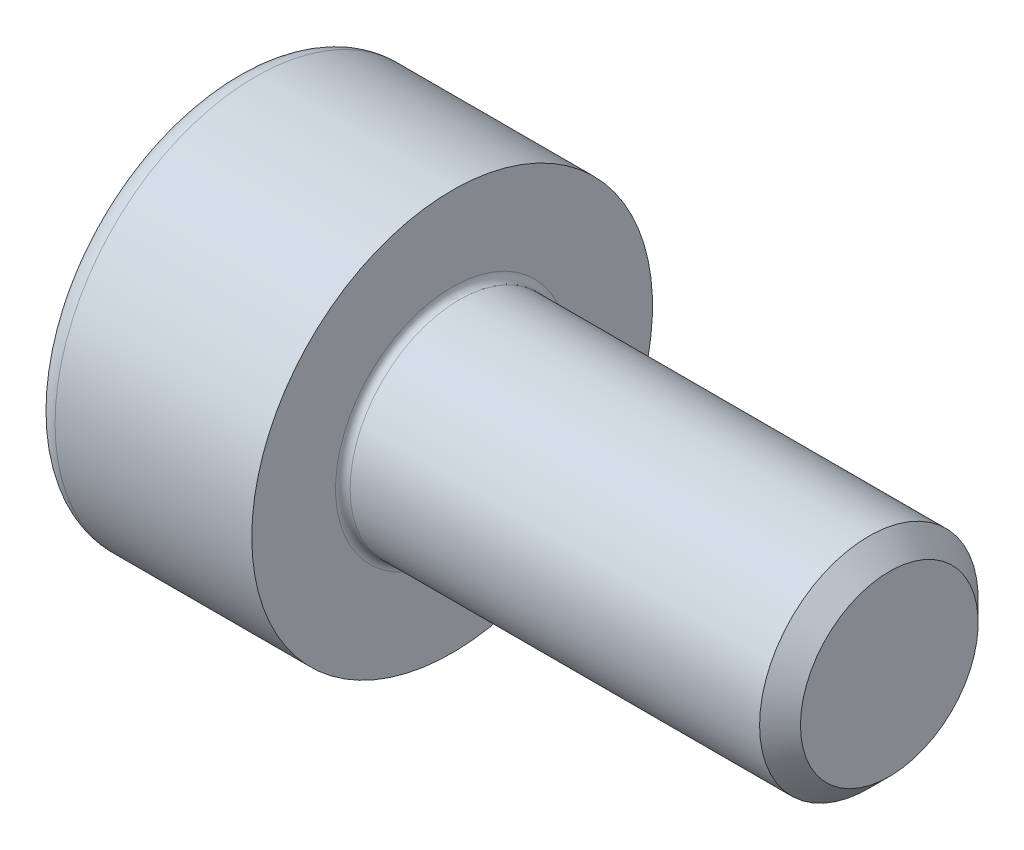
SolidWorks part; units mm, degrees
ref_plane "Plane1" through (0, 0, 0) normal (0, 0, 1) x (1, 0, 0)
ref_plane "Plane2" through (0, 0, 0) normal (0, 1, 0) x (1, 0, 0)
ref_plane "Plane3" through (0, 0, 0) normal (1, 0, 0) x (0, 0, -1)
sketch "BodySke" plane through (0, 0, 0) normal (0, 0, 1) x (1, 0, 0)
  line L0 (0, 0) -> (0, 2.75)
  line L1 (0, 2.75) -> (3, 2.75)
  line L2 (3, 2.75) -> (3, 1.5)
  line L3 (3, 1.5) -> (8.7195, 1.5)
  line L4 (9, 1.2195) -> (9, 0)
  line L5 (9, 0) -> (0, 0)
  line L6 (-31.75, 0) -> (127, 0) construction
  line L8 (9, 1.2195) -> (8.7195, 1.5)
  line L10 (9, -1.2195) -> (8.7195, -1.5) construction
  line L11 (3.5, 9.525) -> (3.5, 3.175) construction
  line L12 (3, 9.525) -> (3, 3.175) construction
  line L13 (-51, 9.525) -> (-51, 3.175) construction
  dimension "Diameter" = 3
  dimension "Head_ht" = 3
  dimension "Length" = 6
  dimension "Body_ch_ang" = 45
  dimension "Head_dia" = 5.5
  dimension "Minor_dia" = 2.439
  dimension "Advance" = 0.5
  dimension "Thread_nom" = 6
  dimension "Thread_length" = 60
revolve "Base-Revolve" add sketch "BodySke" angle 360 about L6
fillet "Fillet1" radius 0.1 1 edges at (3, 0, 1.5)
fillet "Fillet2" radius 0.3 1 edges at (0, 0, 2.75)
sketch "Sketch2" plane through (0, 0, 0) normal (0, 0, 1) x (1, 0, 0)
  line L0 (0, 1.26) -> (1.3, 1.26)
  line L1 (1.3, 1.26) -> (2.0275, 0)
  line L2 (-31.75, 0) -> (127, 0) construction
  line L3 (2.0275, 0) -> (0, 0)
  line L4 (0, 0) -> (0, 1.26)
  line L6 (0, 0) -> (47.625, 0) construction
  dimension "D1" = 1.26
  dimension "D2" = 60
  dimension "Depth" = 1.3
revolve "Hex-PreBroach" cut sketch "Sketch2" angle 360 about L6
sketch "Sketch3" plane through (0, 0, 0) normal (-1, 0, 0) x (0, 0.5, 0.866)
  line L0 (0.7275, 1.26) -> (-0.7275, 1.26)
  line L1 (-0.7275, 1.26) -> (-1.4549, 0)
  line L2 (0.7275, 1.26) -> (1.4549, 0)
  line L3 (0.7275, -1.26) -> (1.4549, 0)
  line L4 (0.7275, -1.26) -> (-0.7275, -1.26)
  line L5 (-0.7275, -1.26) -> (-1.4549, 0)
  dimension "D1" = 1.26
  dimension "D2" = 1.26
  dimension "Hex_size" = 2.52
extrude "Hex" cut sketch "Sketch3" against normal blind 1.3
other "PropertyManager"
equation "\"D2@Sketch3\" = \"Hex_size@Sketch3\" / 2"
equation "\"D1@Sketch3\" = \"Hex_size@Sketch3\" / 2"
equation "\"D1@Sketch2\" = \"Hex_size@Sketch3\" / 2"
equation "\"Depth@Sketch2\" =  \"Key_eng@Hex\""
